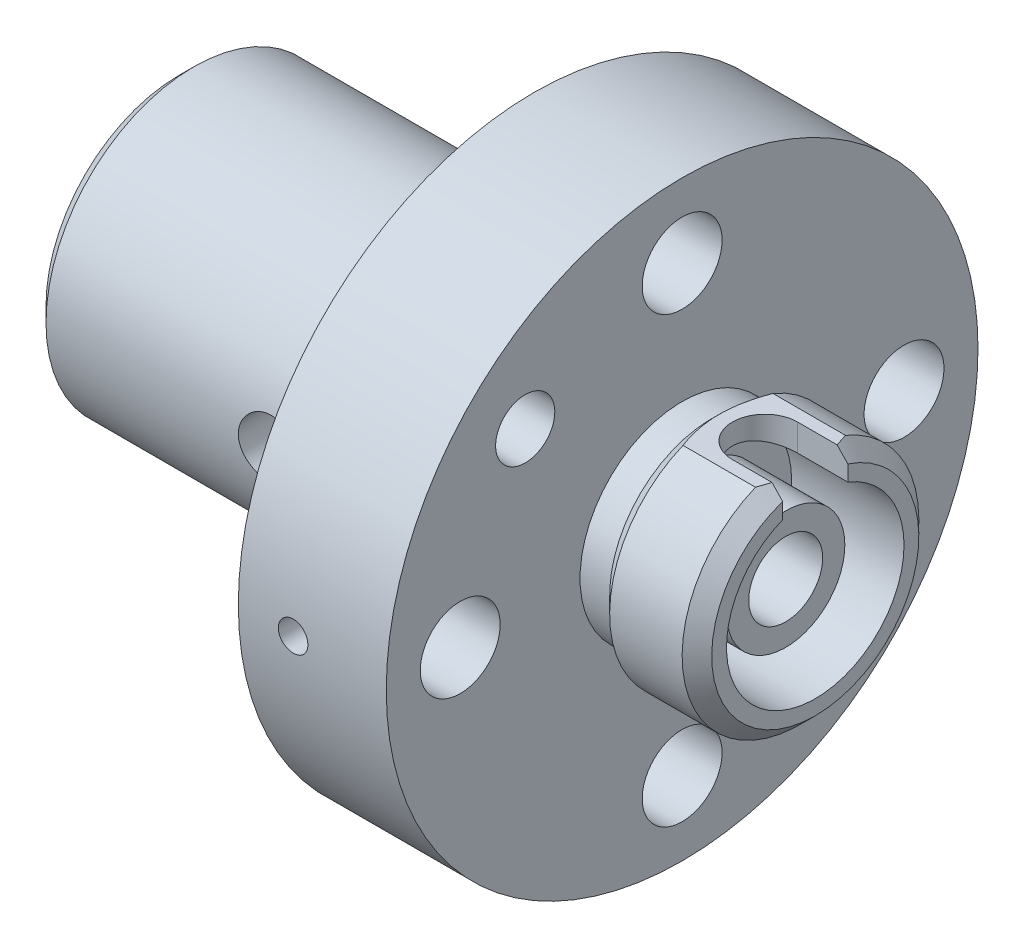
SolidWorks part; units mm, degrees
ref_plane "Vorne" through (0, 0, 0) normal (0, 0, 1) x (1, 0, 0)
ref_plane "Oben" through (0, 0, 0) normal (0, 1, 0) x (1, 0, 0)
ref_plane "Rechts" through (0, 0, 0) normal (1, 0, 0) x (0, 0, -1)
sketch "Skizze1" plane through (0, 0, 0) normal (0, 0, 1) x (1, 0, 0)
  line L0 (0, 0) -> (-9.1862, 0) construction
  line L1 (-12, 1.25) -> (8.5, 1.25)
  line L2 (8.5, 1.25) -> (8.5, 2)
  line L3 (8.5, 2) -> (5.7, 2)
  line L4 (5.7, 2) -> (5.7, 3)
  line L5 (5.7, 3) -> (9.5, 3)
  line L6 (9.5, 3) -> (9.5, 3.5)
  line L7 (9, 4) -> (6.55, 4)
  line L8 (5, 3.45) -> (5, 10)
  line L9 (5, 10) -> (3, 10)
  line L11 (3, 10) -> (0, 10)
  line L12 (0, 10) -> (0, 5)
  line L13 (0, 5) -> (-12, 5)
  line L14 (-12, 5) -> (-12, 1.25)
  line L15 (5, 3.45) -> (6, 3.45)
  line L16 (6, 3.45) -> (6.55, 4)
  line L17 (9.5, 3.5) -> (9, 4)
  dimension "D1" = 2.5
  dimension "D2" = 4
  dimension "D3" = 6
  dimension "D4" = 8
  dimension "D5" = 10
  dimension "D6" = 20
  dimension "D7" = 12
  dimension "D9" = 1
  dimension "D10" = 3.8
  dimension "D11" = 4.5
  dimension "D12" = 21.5
  dimension "D13" = 6.9
  dimension "D14" = 1
  dimension "D15" = 45
  dimension "D16" = 0.5
  dimension "D17" = 45
revolve "Rotation1" add sketch "Skizze1" angle 360 about L0
sketch "Skizze2" plane through (0, 0, 0) normal (0, 0, 1) x (1, 0, 0)
  line L0 (5, -10) -> (5, 10) construction
  line L1 (5, 3.7) -> (9.5, 3.7)
  line L2 (5, 3.7) -> (5, 4.5)
  line L3 (5, 4.5) -> (9.5, 4.5)
  line L4 (9.5, 3.7) -> (9.5, 4.5)
  line L5 (-12, 0) -> (8.5, 0) construction
  line L6 (9.5, -3.5) -> (9.5, 3.5) construction
  dimension "D1" = 3.7
  dimension "D2" = 4.5
extrude "Linear austragen1" cut sketch "Skizze2" against normal through all and the other way through all
sketch "Skizze3" plane through (0, 3.7, 0) normal (0, 1, 0) x (1, 0, 0)
  line L0 (-12, 0) -> (8.5, 0) construction
  line L1 (9.5, -3.5) -> (9.5, 3.5) construction
  line L2 (9.5, -1.1) -> (9.5, 1.1)
  line L3 (7.8, 1.1) -> (9.5, 1.1)
  line L4 (7.8, -1.1) -> (9.5, -1.1)
  arc A0 (7.8, 1.1) -> (7.8, -1.1) centre (7.8, 0) ccw
  dimension "D1" = 2.8
  dimension "D2" = 1.1
extrude "Linear austragen2" cut sketch "Skizze3" against normal up to next
hole_wizard "Ø2.7 (2.7) Durchmesser Bohrung1" positions "Skizze5" profile "Skizze4" hole size "Ø2.7" standard "ISO"
sketch "Skizze5" plane through (5, -0.6551, 0.8558) normal (1, 0, 0) x (0, 0, -1)
  point P0 (0.8558, 8.1551)
  dimension "D1" = 7.5
sketch "Skizze4" plane through (5, 7.5, 0) normal (0, 1, 0) x (0, 0, -1)
  line L0 (0, 0) -> (0, 5.001)
  line L1 (0, 5.001) -> (1.35, 5.001)
  line L2 (1.35, 5.001) -> (1.35, 0)
  line L5 (1.35, 0) -> (0, 0)
  line L11 (0, -6.35) -> (0, 107.95) construction
  dimension "Bohrerdurchmesser" = 2.7
  dimension "Bohrungstiefe" = 5.001
pattern_circular "Kreismuster1" count 4 over 360 about axis through (0, 0, 0) along (1, 0, 0) of "Ø2.7 (2.7) Durchmesser Bohrung1"
sketch "Skizze6" plane through (5, 0, 0) normal (1, 0, 0) x (0, 0, -1)
  line L0 (0, 0) -> (-5.3033, 5.3033) construction
  line L1 (0, 0) -> (-7.5, 0) construction
  line L2 (0, 0) -> (0, -7.5) construction
  line L3 (0, 0) -> (4.3018, -6.1436) construction
  circle A0 centre (0, 0) radius 7.5 construction
  circle A1 centre (-5.3033, 5.3033) radius 1
  circle A2 centre (4.3018, -6.1436) radius 1
  dimension "D3" = 2
  dimension "D4" = 2
  dimension "D1" = 35
  dimension "D2" = 45
extrude "Linear austragen3" cut sketch "Skizze6" against normal up to next
sketch "Skizze7" plane through (0, 0, 0) normal (0, 0, 1) x (1, 0, 0)
  line L0 (-12, 2) -> (-8, 2)
  line L1 (-12, 5) -> (-12, -5) construction
  line L2 (-8, 2) -> (-8, 0)
  line L3 (-8, 0) -> (-12, 0)
  line L4 (-12, 1.25) -> (-12, -1.25) construction
  line L5 (-12, 0) -> (-12, 2)
  line L6 (0, 0) -> (-5.9006, 0) construction
  dimension "D1" = 4
  dimension "D2" = 4
revolve "Schnitt-Rotation1" cut sketch "Skizze7" angle 360 about L6
sketch "Skizze8" plane through (0, 0, 0) normal (0, 0, 1) x (1, 0, 0)
  line L0 (-12, 2) -> (-12, -2) construction
  circle A0 centre (-4, 0) radius 1
  dimension "D1" = 2
  dimension "D2" = 8
extrude "Linear austragen4" cut sketch "Skizze8" against normal mid plane 49
chamfer "Fase1" distance 0.5 angle 45 1 edges at (-12, 0, -5)
sketch "Skizze9" plane through (0, 0, 0) normal (0, 0, 1) x (1, 0, 0)
  line L0 (-8, 0) -> (8.5, 0) construction
  line L1 (9.5, -3.5) -> (9.5, 3.3226) construction
  circle A0 centre (1.85, 0) radius 0.5
  dimension "D1" = 1
  dimension "D2" = 7.65
extrude "Linear austragen5" cut sketch "Skizze9" against normal mid plane 89
